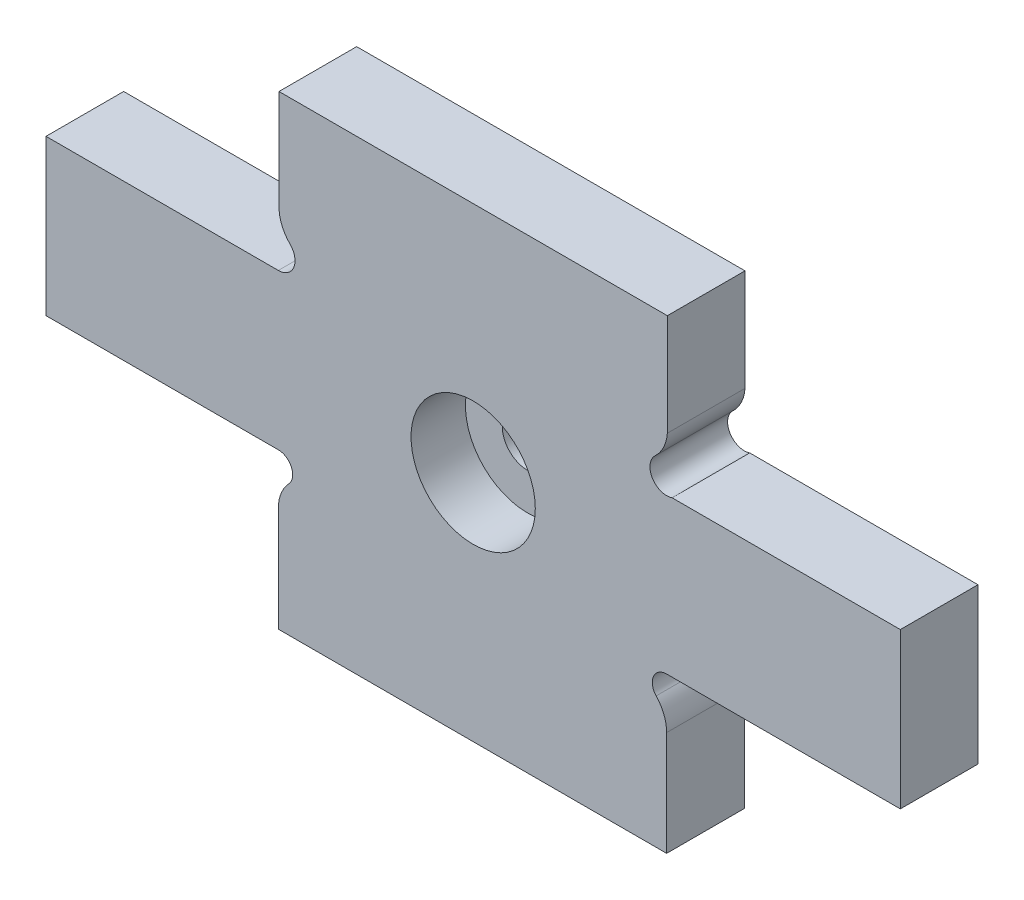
SolidWorks part; units mm, degrees
ref_plane "Plan de face" through (0, 0, 0) normal (0, 0, 1) x (1, 0, 0)
ref_plane "Plan de dessus" through (0, 0, 0) normal (0, 1, 0) x (1, 0, 0)
ref_plane "Plan de droite" through (0, 0, 0) normal (1, 0, 0) x (0, 0, -1)
sketch "Esquisse1" plane through (0, 0, 0) normal (0, 0, 1) x (1, 0, 0)
  line L0 (24.9125, -10) -> (55, -10)
  line L1 (55, -10) -> (55, 10)
  line L2 (55, 10) -> (25.6055, 10)
  line L3 (25, 16.8961) -> (25, 30)
  line L4 (25, 30) -> (-25, 30)
  line L5 (-25, 30) -> (-25, 16.8961)
  line L6 (-25.0875, 10) -> (-55, 10)
  line L7 (-55, 10) -> (-55, -10)
  line L8 (-55, -10) -> (-25.0875, -10)
  line L9 (-25.0875, -16.5321) -> (-25.0875, -30)
  line L10 (-25.0875, -30) -> (24.9125, -30)
  line L11 (24.9125, -30) -> (24.9125, -16.5321)
  line L12 (55, 0) -> (-55, 0) construction
  arc A1 (24.9125, -16.5321) -> (23.5622, -13.1145) centre (19.9125, -16.5321) ccw
  arc A2 (24.9125, -10) -> (23.5622, -13.1145) centre (24.9125, -11.85) ccw
  arc A3 (23.492, 13.6581) -> (25.6055, 10) centre (24.9125, 12.0392) ccw
  arc A4 (23.492, 13.6581) -> (25, 16.8961) centre (20.0125, 17.2488) ccw
  arc A5 (-25, 16.8961) -> (-23.5181, 13.6196) centre (-20.0081, 17.1804) ccw
  arc A6 (-25.0875, 10) -> (-23.5181, 13.6196) centre (-25.0875, 12.15) ccw
  arc A7 (-23.7371, -13.1145) -> (-25.0875, -10) centre (-25.0875, -11.85) ccw
  arc A8 (-23.7371, -13.1145) -> (-25.0875, -16.5321) centre (-20.0875, -16.5321) ccw
  dimension "D12" = 1.85
  dimension "D1" = 20
  dimension "D2" = 20
  dimension "D3" = 60
  dimension "D4" = 50
  dimension "D5" = 30
  dimension "D6" = 30
  dimension "D7" = 30
  dimension "D8" = 25
  dimension "D9" = 50
  dimension "D10" = 50
  dimension "D11" = 24
  dimension "D13" = 20
  dimension "D14" = 20
extrude "Boss.-Extru.1" add sketch "Esquisse1" along normal blind 10
sketch "Esquisse2" plane through (0, 0, 0) normal (0, 0, 1) x (1, 0, 0)
  circle A2 centre (0, 0) radius 3.25
  dimension "D1" = 6.5
extrude "Enlèv. mat.-Extru.1" cut sketch "Esquisse2" along normal blind 10
sketch "Esquisse3" plane through (0, 0, 10) normal (0, 0, 1) x (1, 0, 0)
  circle A0 centre (0, 0) radius 8
  dimension "D1" = 16
extrude "Enlèv. mat.-Extru.2" cut sketch "Esquisse3" against normal blind 7
